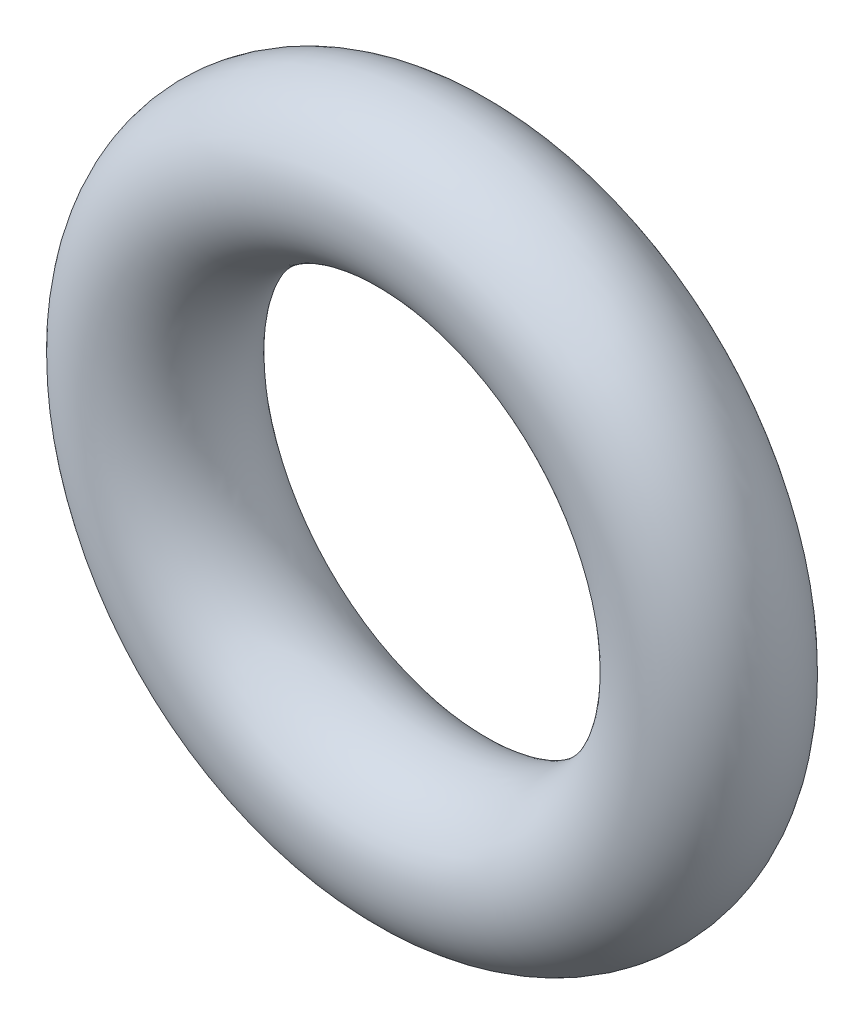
SolidWorks part; units mm, degrees
ref_plane "前视基准面" through (0, 0, 0) normal (0, 0, 1) x (1, 0, 0)
ref_plane "上视基准面" through (0, 0, 0) normal (0, 1, 0) x (1, 0, 0)
ref_plane "右视基准面" through (0, 0, 0) normal (1, 0, 0) x (0, 0, -1)
sketch "草图1" plane through (0, 0, 0) normal (0, 1, 0) x (1, 0, 0)
  line L0 (0, 70.5971) -> (0, -58.2706) construction
  line L1 (-36, 70.5971) -> (-36, -63.5) construction
  line L2 (-101.7868, 0) -> (61.8191, 0) construction
  circle A0 centre (0, 0) radius 10
  dimension "D1" = 20
  dimension "D2" = 36
revolve "旋转1" add sketch "草图1" angle 360 about L1
